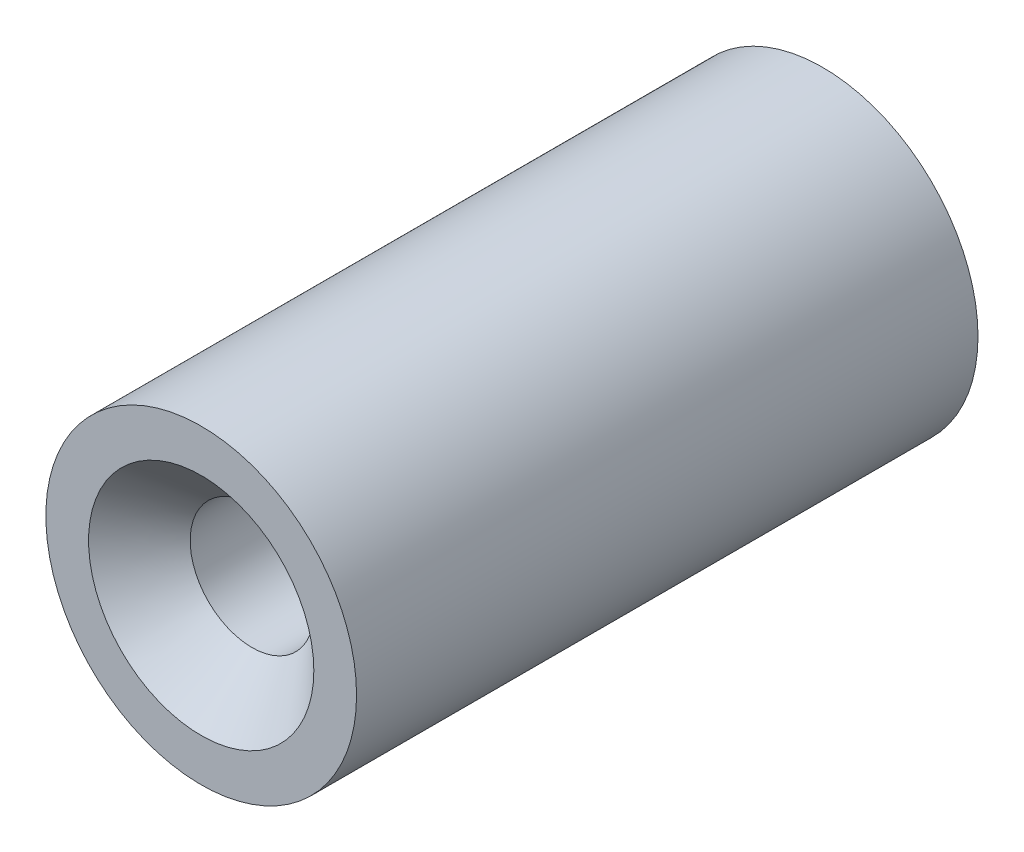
SolidWorks part; units mm, degrees
ref_plane "Front Plane" through (0, 0, 0) normal (0, 0, 1) x (1, 0, 0)
ref_plane "Top Plane" through (0, 0, 0) normal (0, 1, 0) x (1, 0, 0)
ref_plane "Right Plane" through (0, 0, 0) normal (1, 0, 0) x (0, 0, -1)
sketch "Sketch1" plane through (0, 0, 0) normal (0, 0, 1) x (1, 0, 0)
  circle A0 centre (-32.0316, 23.0112) radius 6.35
extrude "Boss-Extrude1" add sketch "Sketch1" along normal blind 25.4
hole_wizard "#8 (0.199) Diameter Hole1" positions "Sketch2" profile "Sketch3" hole size "#8" standard "ANSI Inch"
sketch "Sketch2" plane through (0, 0, 25.4) normal (0, 0, 1) x (1, 0, 0)
  circle A0 centre (-32.0316, 23.0112) radius 6.35 construction
  point P0 (-32.0316, 23.0112)
  dimension "D1" = 0
sketch "Sketch3" plane through (-32.0316, 23.0112, 25.4) normal (1, 0, 0) x (0, -1, 0)
  line L0 (0, 0) -> (0, 25.4)
  line L1 (0, 25.4) -> (2.5273, 25.4)
  line L2 (2.5273, 25.4) -> (2.5273, 2.0765)
  line L3 (2.5273, 2.0765) -> (4.6037, 0)
  line L5 (4.6037, 0) -> (0, 0)
  line L6 (-2.5273, 2.0765) -> (-4.6037, 0) construction
  line L11 (0, -6.35) -> (0, 107.95) construction
  dimension "Thru Hole Dia." = 5.0546
  dimension "Thru Hole Depth" = 25.4
  dimension "Near C'Sink Dia." = 9.2075
  dimension "Near C'Sink Angle" = 90
